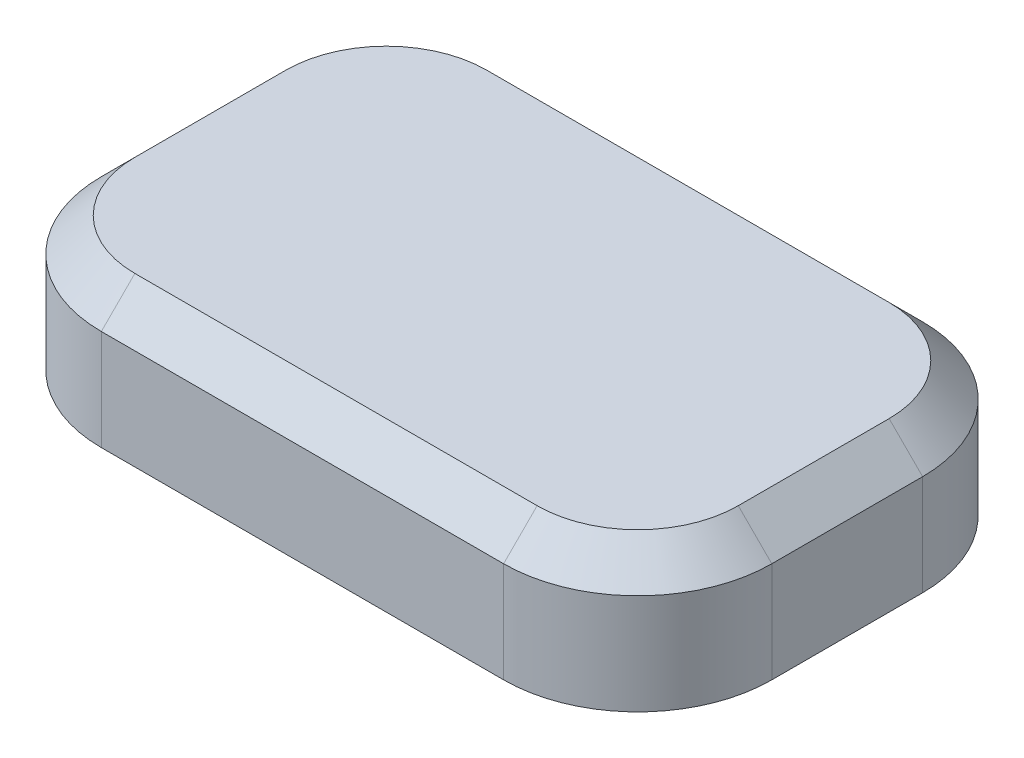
SolidWorks part; units mm, degrees
ref_plane "Front" through (0, 0, 0) normal (0, 0, 1) x (1, 0, 0)
ref_plane "Top" through (0, 0, 0) normal (0, 1, 0) x (1, 0, 0)
ref_plane "Right" through (0, 0, 0) normal (1, 0, 0) x (0, 0, -1)
sketch "Sketch1" plane through (0, 0, 0) normal (0, 1, 0) x (1, 0, 0)
  line L0 (100, -62.5) -> (-100, 62.5) construction
  line L1 (-100, 62.5) -> (100, 62.5)
  line L2 (-100, 62.5) -> (-100, -62.5)
  line L3 (-100, -62.5) -> (100, -62.5)
  line L4 (100, 62.5) -> (100, -62.5)
  dimension "D1" = 200
  dimension "D2" = 125
extrude "Extrude1" add sketch "Sketch1" along normal blind 40
fillet "Fillet1" radius 40 4 edges at (-100, 20, -62.5) (-100, 20, 62.5) (100, 20, -62.5) (100, 20, 62.5)
chamfer "Chamfer3" distance 10 8 edges at (0, 40, -62.5) (-88.2843, 40, -50.7843) (88.2843, 40, -50.7843) (-100, 40, 0) (100, 40, 0) (-88.2843, 40, 50.7843) (88.2843, 40, 50.7843) (0, 40, 62.5)
